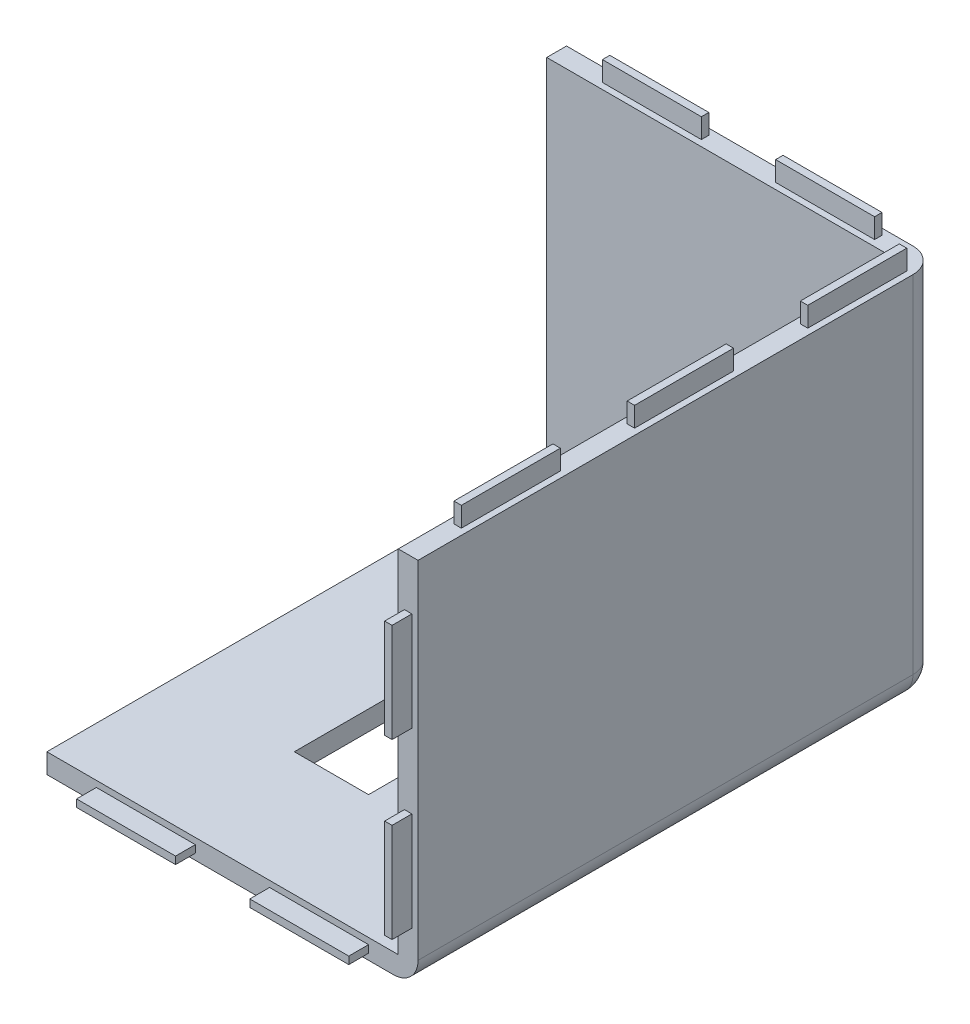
SolidWorks part; units mm, degrees
ref_plane "Alzado" through (0, 0, 0) normal (0, 0, 1) x (1, 0, 0)
ref_plane "Planta" through (0, 0, 0) normal (0, 1, 0) x (1, 0, 0)
ref_plane "Vista lateral" through (0, 0, 0) normal (1, 0, 0) x (0, 0, -1)
sketch "Croquis1" plane through (0, 0, 0) normal (0, 1, 0) x (1, 0, 0)
  line L1 (0, 0) -> (150, 0)
  line L2 (0, 0) -> (0, 210)
  line L3 (0, 210) -> (150, 210)
  line L4 (150, 0) -> (150, 210)
  dimension "D1" = 150
  dimension "D2" = 210
extrude "Saliente-Extruir1" add sketch "Croquis1" along normal blind 150
sketch "Croquis2" plane through (0, 150, 0) normal (0, 1, 0) x (1, 0, 0)
  line L1 (0, 202) -> (142, 202)
  line L2 (0, 202) -> (0, 0)
  line L3 (0, 0) -> (142, 0)
  line L4 (142, 202) -> (142, 0)
  line L5 (150, 210) -> (0, 210) construction
  line L8 (0, 0) -> (150, 0) construction
  line L9 (0, 210) -> (0, 0) construction
  line L10 (150, 0) -> (150, 210) construction
  point P5 (0, 0)
  dimension "D1" = 8
  dimension "D2" = 8
  dimension "D4" = 0
extrude "Cortar-Extruir1" cut sketch "Croquis2" against normal blind 142
sketch "Croquis8" plane through (0, 150, 0) normal (0, 1, 0) x (1, 0, 0)
  line L0 (0, 210) -> (0, 202) construction
  line L1 (20, 207.5) -> (60, 207.5)
  line L2 (20, 207.5) -> (20, 204.5)
  line L3 (20, 204.5) -> (60, 204.5)
  line L4 (60, 207.5) -> (60, 204.5)
  line L5 (90, 207.5) -> (130, 207.5)
  line L6 (90, 207.5) -> (90, 204.5)
  line L7 (90, 204.5) -> (130, 204.5)
  line L8 (130, 207.5) -> (130, 204.5)
  line L9 (150, 210) -> (0, 210) construction
  line L10 (142, 0) -> (150, 0) construction
  line L11 (144.5, 20) -> (147.5, 20)
  line L12 (144.5, 20) -> (144.5, 60)
  line L13 (144.5, 60) -> (147.5, 60)
  line L14 (147.5, 20) -> (147.5, 60)
  line L15 (144.5, 90) -> (147.5, 90)
  line L16 (144.5, 90) -> (144.5, 130)
  line L17 (144.5, 130) -> (147.5, 130)
  line L18 (147.5, 90) -> (147.5, 130)
  line L19 (144.5, 160) -> (147.5, 160)
  line L20 (144.5, 160) -> (144.5, 200)
  line L21 (144.5, 200) -> (147.5, 200)
  line L22 (147.5, 160) -> (147.5, 200)
  line L23 (150, 0) -> (150, 210) construction
  dimension "D1" = 3
  dimension "D2" = 3
  dimension "D3" = 20
  dimension "D4" = 40
  dimension "D5" = 30
  dimension "D6" = 40
  dimension "D7" = 2.5
  dimension "D8" = 2.5
  dimension "D9" = 40
  dimension "D10" = 40
  dimension "D11" = 40
  dimension "D12" = 20
  dimension "D13" = 30
  dimension "D14" = 30
  dimension "D15" = 3
  dimension "D16" = 3
  dimension "D17" = 3
  dimension "D18" = 2.5
  dimension "D19" = 2.5
  dimension "D20" = 2.5
extrude "Saliente-Extruir5" add sketch "Croquis8" along normal blind 8
sketch "Croquis9" plane through (0, 0, 0) normal (-1, 0, 0) x (0, 0, 1)
  line L0 (-210, 150) -> (-202, 150) construction
  line L1 (-207.5, 130) -> (-204.5, 130)
  line L2 (-207.5, 130) -> (-207.5, 90)
  line L3 (-207.5, 90) -> (-204.5, 90)
  line L4 (-204.5, 130) -> (-204.5, 90)
  line L5 (-207.5, 60) -> (-204.5, 60)
  line L6 (-207.5, 60) -> (-207.5, 20)
  line L7 (-207.5, 20) -> (-204.5, 20)
  line L8 (-204.5, 60) -> (-204.5, 20)
  line L9 (-20, 5.5) -> (-60, 5.5)
  line L10 (-20, 5.5) -> (-20, 2.5)
  line L11 (-20, 2.5) -> (-60, 2.5)
  line L12 (-60, 5.5) -> (-60, 2.5)
  line L13 (-90, 5.5) -> (-130, 5.5)
  line L14 (-90, 5.5) -> (-90, 2.5)
  line L15 (-90, 2.5) -> (-130, 2.5)
  line L16 (-130, 5.5) -> (-130, 2.5)
  line L17 (-160, 5.5) -> (-200, 5.5)
  line L18 (-160, 5.5) -> (-160, 2.5)
  line L19 (-160, 2.5) -> (-200, 2.5)
  line L20 (-200, 5.5) -> (-200, 2.5)
  line L21 (0, 8) -> (0, 0) construction
  line L22 (-210, 0) -> (0, 0) construction
  line L23 (-210, 150) -> (-210, 0) construction
  dimension "D1" = 40
  dimension "D2" = 40
  dimension "D3" = 30
  dimension "D4" = 20
  dimension "D5" = 40
  dimension "D6" = 40
  dimension "D7" = 40
  dimension "D8" = 30
  dimension "D9" = 30
  dimension "D10" = 20
  dimension "D11" = 3
  dimension "D12" = 3
  dimension "D13" = 3
  dimension "D14" = 2.5
  dimension "D15" = 2.5
  dimension "D16" = 2.5
  dimension "D17" = 3
  dimension "D18" = 3
  dimension "D19" = 2.5
  dimension "D20" = 2.5
extrude "Cortar-Extruir5" cut sketch "Croquis9" against normal blind 8
sketch "Croquis10" plane through (0, 0, 0) normal (0, 0, 1) x (1, 0, 0)
  line L0 (142, 150) -> (150, 150) construction
  line L1 (144.5, 130) -> (147.5, 130)
  line L2 (144.5, 130) -> (144.5, 90)
  line L3 (144.5, 90) -> (147.5, 90)
  line L4 (147.5, 130) -> (147.5, 90)
  line L5 (144.5, 60) -> (147.5, 60)
  line L6 (144.5, 60) -> (144.5, 20)
  line L7 (144.5, 20) -> (147.5, 20)
  line L8 (147.5, 60) -> (147.5, 20)
  line L9 (20, 5.5) -> (60, 5.5)
  line L10 (20, 5.5) -> (20, 2.5)
  line L11 (20, 2.5) -> (60, 2.5)
  line L12 (60, 5.5) -> (60, 2.5)
  line L13 (90, 5.5) -> (130, 5.5)
  line L14 (90, 5.5) -> (90, 2.5)
  line L15 (90, 2.5) -> (130, 2.5)
  line L16 (130, 5.5) -> (130, 2.5)
  line L17 (150, 150) -> (150, 0) construction
  line L18 (0, 8) -> (0, 0) construction
  line L19 (0, 0) -> (150, 0) construction
  dimension "D1" = 40
  dimension "D2" = 40
  dimension "D3" = 20
  dimension "D4" = 30
  dimension "D5" = 3
  dimension "D6" = 3
  dimension "D7" = 2.5
  dimension "D8" = 2.5
  dimension "D9" = 40
  dimension "D10" = 40
  dimension "D11" = 30
  dimension "D12" = 20
  dimension "D13" = 3
  dimension "D14" = 3
  dimension "D15" = 2.5
  dimension "D16" = 2.5
extrude "Saliente-Extruir6" add sketch "Croquis10" along normal blind 8
sketch "Croquis11" plane through (0, 8, 0) normal (0, 1, 0) x (1, 0, 0)
  line L0 (0, 202) -> (0, 0) construction
  line L1 (50, 110) -> (80, 110)
  line L2 (50, 110) -> (50, 50)
  line L3 (50, 50) -> (80, 50)
  line L4 (80, 110) -> (80, 50)
  line L5 (0, 0) -> (142, 0) construction
  dimension "D1" = 30
  dimension "D2" = 60
  dimension "D3" = 50
  dimension "D4" = 50
extrude "Cortar-Extruir6" cut sketch "Croquis11" against normal blind 8
fillet "Redondeo2" radius 10 3 edges at (75, 0, -210) (150, 0, -105) (150, 75, -210)
